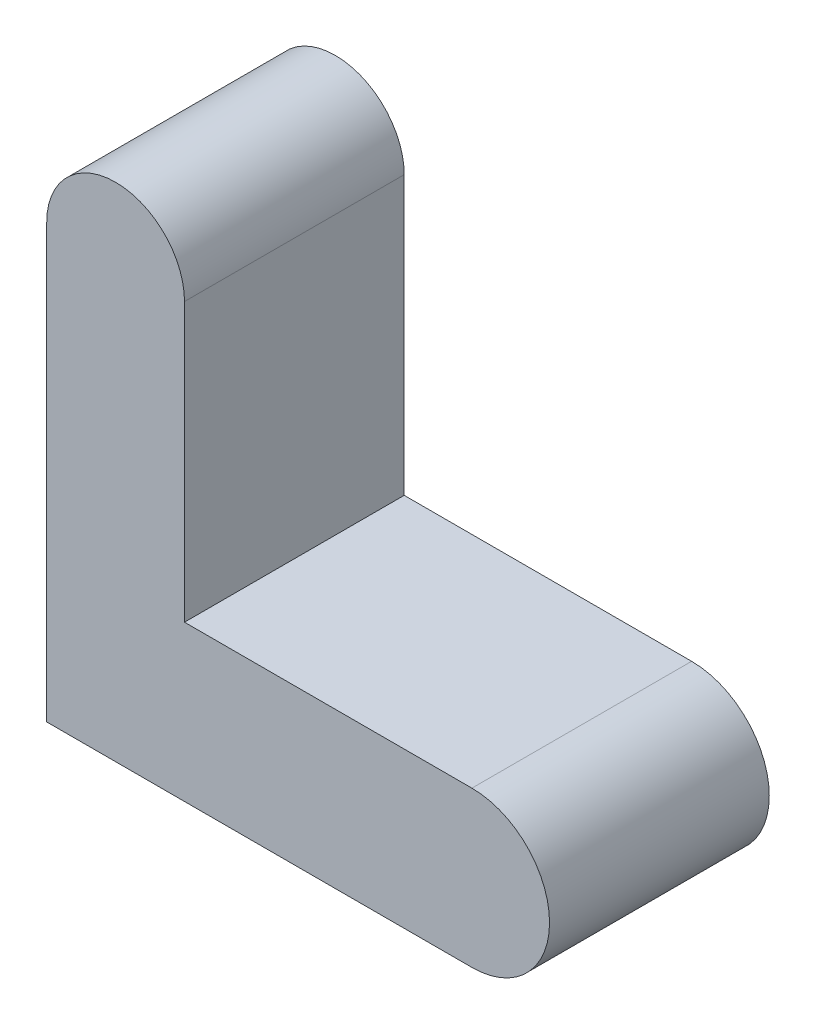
SolidWorks part; units mm, degrees
ref_plane "FrontPlane" through (0, 0, 0) normal (0, 0, 1) x (1, 0, 0)
ref_plane "Top" through (0, 0, 0) normal (0, 1, 0) x (1, 0, 0)
ref_plane "Right" through (0, 0, 0) normal (1, 0, 0) x (0, 0, -1)
ref_plane "Plane1" through (0, 0, 75.1895) normal (0, 0, 1) x (1, 0, 0)
sketch "Sketch1" plane through (0, 0, 0) normal (0, 0, 1) x (1, 0, 0)
  line L0 (-61.3036, -19.4349) -> (45.1263, -19.4349)
  line L1 (45.1263, 19.4349) -> (-26.8203, 19.4349)
  line L2 (-26.8203, 19.4349) -> (-26.8203, 88.9544)
  line L3 (-61.3036, 88.9544) -> (-61.3036, -19.4349)
  arc A0 (45.1263, -19.4349) -> (45.1263, 19.4349) centre (45.1263, 0) ccw
  arc A1 (-26.8203, 88.9544) -> (-61.3036, 88.9544) centre (-44.062, 88.9544) ccw
extrude "Boss-Extrude2" add sketch "Sketch1" along direction (0, 0, 1) on the side of the normal blind 55 from offset 50
